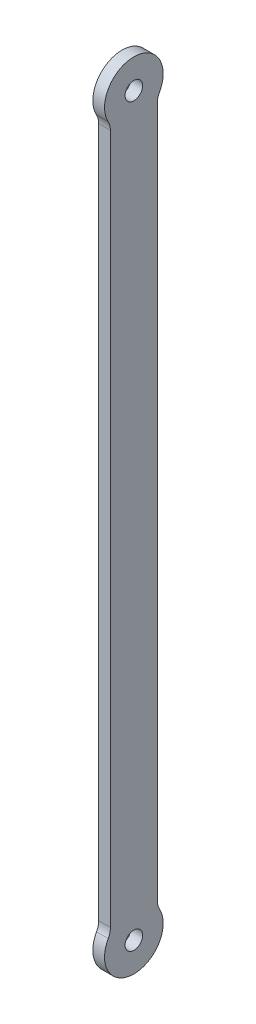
SolidWorks part; units mm, degrees
ref_plane "Front Plane" through (0, 0, 0) normal (0, 0, 1) x (1, 0, 0)
ref_plane "Top Plane" through (0, 0, 0) normal (0, 1, 0) x (1, 0, 0)
ref_plane "Right Plane" through (0, 0, 0) normal (1, 0, 0) x (0, 0, -1)
sketch "Sketch1" plane through (0, 0, 0) normal (1, 0, 0) x (0, 0, -1)
  line L0 (0, 0) -> (0, 125.52) construction
  line L1 (-4, 0) -> (-4, 125.52)
  line L2 (4, 0) -> (4, 125.52)
  arc A0 (-4, 0) -> (4, 0) centre (0, 0) ccw
  arc A1 (4, 125.52) -> (-4, 125.52) centre (0, 125.52) ccw
  circle A2 centre (0, 125.52) radius 1.5
  circle A3 centre (0, 0) radius 1.5
  point P3 (0, 62.76)
  dimension "D2" = 3
  dimension "D1" = 125.52
  dimension "D3" = 8
extrude "Boss-Extrude1" add sketch "Sketch1" along normal blind 2
sketch "Sketch2" plane through (2, 0, 0) normal (1, 0, 0) x (0, 0, -1)
  circle A0 centre (0, 125.52) radius 1.5 construction
  circle A1 centre (0, 125.52) radius 1.5
  circle A2 centre (0, 125.52) radius 5
  circle A3 centre (0, 0) radius 1.5 construction
  circle A4 centre (0, 0) radius 1.5
  circle A5 centre (0, 0) radius 5
  dimension "D1" = 10
extrude "Boss-Extrude2" add sketch "Sketch2" against normal up to surface (2 mm away)
fillet "Fillet1" radius 3 4 edges at (1, 3, 4) (1, 3, -4) (1, 122.52, -4) (1, 122.52, 4)
